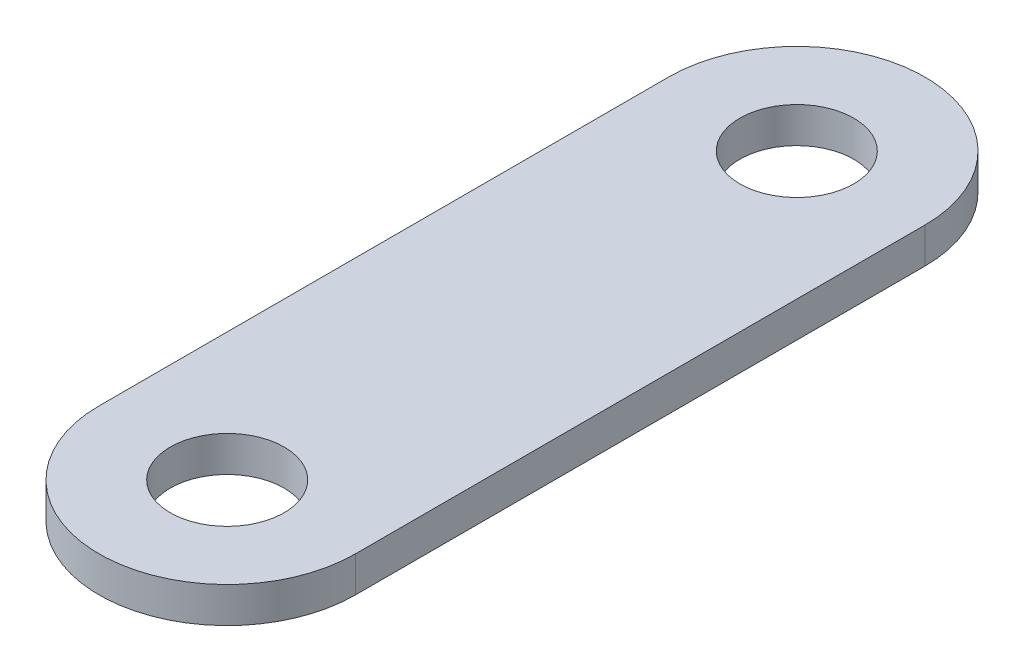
SolidWorks part; units mm, degrees
ref_plane "Front" through (0, 0, 0) normal (0, 0, 1) x (1, 0, 0)
ref_plane "Top" through (0, 0, 0) normal (0, 1, 0) x (1, 0, 0)
ref_plane "Right" through (0, 0, 0) normal (1, 0, 0) x (0, 0, -1)
sketch "Sketch1" plane through (0, 0, 0) normal (0, 1, 0) x (1, 0, 0)
  line L0 (0, 9.6) -> (-7.5377, 9.6) construction
  line L1 (-3.6, 8) -> (3.6, 8) construction
  line L2 (-3.6, 8) -> (-3.6, 0)
  line L3 (-3.6, 0) -> (3.6, 0)
  line L4 (3.6, 8) -> (3.6, 0)
  line L5 (0, 11.6) -> (-7.5377, 11.6) construction
  circle A0 centre (0, 8) radius 1.6
  arc A1 (-3.6, 8) -> (3.6, 8) centre (0, 8) cw
  point P4 (0, 0)
  dimension "D1" = 3.2
  dimension "D2" = 2
  dimension "D3" = 8
extrude "Boss-Extrude1" add sketch "Sketch1" along normal blind 1
mirror "Mirror1" about plane through (-3.6, 1, 0) normal (0, 0, -1)
